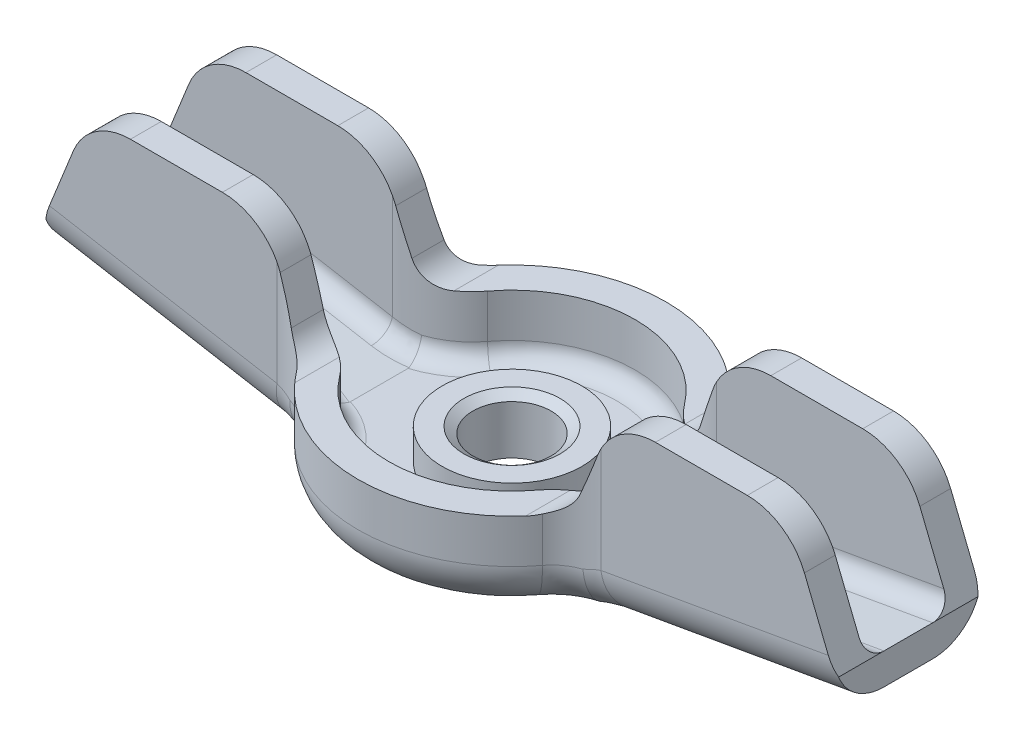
SolidWorks part; units mm, degrees
ref_plane "Front Plane" through (0, 0, 0) normal (0, 0, 1) x (1, 0, 0)
ref_plane "Top Plane" through (0, 0, 0) normal (0, 1, 0) x (1, 0, 0)
ref_plane "Right Plane" through (0, 0, 0) normal (1, 0, 0) x (0, 0, -1)
sketch "WingSke" plane through (0, 0, 0) normal (0, 1, 0) x (1, 0, 0)
  line L0 (4.4703, 2.413) -> (13.081, 2.413)
  line L1 (-13.081, 2.413) -> (-4.4703, 2.413)
  line L2 (-13.081, 2.413) -> (-13.081, -2.413)
  line L3 (-13.081, -2.413) -> (-4.4703, -2.413)
  line L4 (13.081, 2.413) -> (13.081, -2.413)
  line L5 (-13.081, 2.413) -> (13.081, -2.413) construction
  line L6 (-13.081, -2.413) -> (13.081, 2.413) construction
  line L7 (4.4703, -2.413) -> (13.081, -2.413)
  line L8 (-3.81, 3.3601) -> (-3.81, -3.3601) construction
  line L9 (3.81, -3.3601) -> (3.81, 3.3601) construction
  arc A2 (4.4703, 2.413) -> (-4.4703, 2.413) centre (0, 0) ccw
  circle A3 centre (0, 0) radius 4.064 construction
  arc A4 (-4.4703, -2.413) -> (4.4703, -2.413) centre (0, 0) ccw
  circle A5 centre (0, 0) radius 1.2891
extrude "Wing" add sketch "WingSke" along normal blind 6.35
sketch "WallSke" plane through (0, 0, 0) normal (0, 0, 1) x (1, 0, 0)
  line L3 (-3.81, 3.048) -> (3.81, 3.048)
  line L5 (-13.081, 1.5183) -> (-4.4703, 0)
  line L6 (-4.4703, 0) -> (-4.4703, -2.54)
  line L7 (-4.4703, -2.54) -> (-13.081, -2.54)
  line L8 (-13.081, -2.54) -> (-13.081, 1.5183)
  line L9 (-13.081, 6.35) -> (-13.081, 0) construction
  line L11 (4.4703, 0) -> (4.4703, -2.54)
  line L12 (4.4703, -2.54) -> (13.081, -2.54)
  line L13 (13.081, -2.54) -> (13.081, 1.5183)
  line L14 (13.081, 6.35) -> (13.081, 0) construction
  line L15 (-5.2366, 5.013) -> (-4.7647, 3.7165)
  line L16 (-13.081, 2.55) -> (-12.065, 5.0762)
  line L17 (-13.081, 6.35) -> (-4.4703, 6.35) construction
  line L18 (-4.4703, 6.35) -> (-4.4703, 0) construction
  line L19 (-4.4703, 6.35) -> (-4.4703, 7.366) construction
  line L20 (4.4703, 0) -> (13.081, 1.5183)
  line L21 (-13.081, 1.5183) -> (-12.9046, 2.5189) construction
  line L22 (-12.9046, 2.5189) -> (-13.081, 2.55) construction
  line L23 (-13.081, 2.55) -> (-13.081, 7.366)
  line L24 (-13.081, 7.366) -> (13.081, 7.366)
  line L25 (13.081, 7.366) -> (13.081, 2.55)
  line L26 (4.7647, 3.7165) -> (5.2366, 5.013)
  line L27 (-12.065, 5.0762) -> (-13.081, 5.0762) construction
  line L28 (-10.1798, 6.35) -> (-7.1461, 6.35)
  line L29 (13.081, 2.55) -> (12.065, 5.0762)
  line L30 (4.4703, 6.35) -> (13.081, 6.35) construction
  line L31 (10.1798, 6.35) -> (7.1461, 6.35)
  arc A4 (3.81, 3.048) -> (4.7647, 3.7165) centre (3.81, 4.064) ccw
  arc A5 (-4.7647, 3.7165) -> (-3.81, 3.048) centre (-3.81, 4.064) ccw
  arc A6 (12.065, 5.0762) -> (10.1798, 6.35) centre (10.1798, 4.318) ccw
  arc A7 (-12.065, 5.0762) -> (-10.1798, 6.35) centre (-10.1798, 4.318) cw
  arc A8 (7.1461, 6.35) -> (5.2366, 5.013) centre (7.1461, 4.318) ccw
  arc A9 (-7.1461, 6.35) -> (-5.2366, 5.013) centre (-7.1461, 4.318) cw
  point P6 (0, 3.048)
  point P38 (11.5527, 6.35)
  point P47 (-11.5527, 6.35)
fillet "Fillet5" radius 1.6087 4 edges at (4.4703, 3.175, -2.413) (-4.4703, 3.175, -2.413) (4.4703, 3.175, 2.413) (-4.4703, 3.175, 2.413)
extrude "Wall" cut sketch "WallSke" against normal through all both and the other way through all
fillet "Fillet4" radius 1.6087 14 edges at (-9.2128, 0.8362, 2.413) (-9.2128, 0.8362, -2.413) (0, 0, -5.08) (0, 0, 5.08) (4.2479, 0, -2.8448) (-4.2479, 0, -2.8448) (-4.8888, 0.0738, -2.4789) (4.2479, 0, 2.8448) (-4.2479, 0, 2.8448) (-4.8888, 0.0738, 2.4789) (4.8888, 0.0738, 2.4789) (4.8888, 0.0738, -2.4789) (9.2128, 0.8362, 2.413) (9.2128, 0.8362, -2.413)
shell "WingShell" thickness 1.016
sketch "ChamferSke" plane through (0, 0, 0) normal (0, 0, 1) x (1, 0, 0)
  line L0 (1.2891, 1.823) -> (1.5875, 2.032)
  line L1 (1.5875, 2.032) -> (2.3051, 2.032)
  line L2 (2.3051, 2.032) -> (2.3051, 3.048)
  line L3 (2.3051, 3.048) -> (1.2891, 3.048)
  line L4 (1.2891, 3.048) -> (1.2891, 1.823)
  line L5 (1.2891, 0.209) -> (1.5875, 0)
  line L6 (-2.7738, 0) -> (2.7738, 0) construction
  line L7 (1.5875, 0) -> (1.2891, 0)
  line L8 (1.2891, 0) -> (1.2891, 0.209)
  line L9 (0, 0) -> (0, 3.048) construction
  line L10 (3.81, 3.048) -> (-3.81, 3.048) construction
  line L11 (2.3051, 1.016) -> (2.3051, 3.048) construction
  line L12 (2.3051, 3.048) -> (-2.3051, 3.048) construction
revolve "Chamfers" cut sketch "ChamferSke" angle 360 about L9
sketch "ThdSchSke" plane through (0, 0, 0) normal (0, 0, 1) x (1, 0, 0)
  line L0 (0, 0) -> (0, 2.032) construction
  line L2 (-0.6445, 2.2156) -> (-0.6445, 1.7976)
  line L3 (-0.6445, 1.7976) -> (-1.2891, 1.7976)
  line L4 (-1.2891, 1.7976) -> (-1.5875, 2.0066)
  line L5 (-1.5875, 2.0066) -> (-1.2891, 2.2156)
  line L6 (-1.2891, 2.2156) -> (-0.6445, 2.2156)
  line L7 (0, 1.4783) -> (1.8294, 1.4783) construction
  line L8 (2.3051, 2.032) -> (-2.305, 2.032) construction
  line L9 (1.5875, 2.032) -> (-1.5875, 2.032) construction
revolve "ThreadSchematic" [suppressed] cut sketch "ThdSchSke" angle 360 about L0
pattern_linear "ThdSchPat" [suppressed] count 5 spacing 0.5017
equation "\"D1@Fillet4\"=\"WingThicknessC@WingSke\"/3"
equation "\"D1@Fillet5\"=\"WingThicknessC@WingSke\"/3"
equation "\"D1@ChamferSke\" = \"Thread_Major@ThreadCosmetic\" * 0.5"
equation "\"D1@ThdSchPat\"=int(  (\"BossHeightG@ChamferSke\" - 0.002 ) / \"Advance@ThdSchSke\" + 0.999 )  + 1"
equation "\"Thread_major@ThdSchSke\"=\"Thread_Major@ThreadCosmetic\""
equation "\"Tap_drill@ThdSchSke\"=\"Thread_min@WingSke\""
equation "\"D3@WallSke\"=\"ThicknessT@WingSke\""
equation "\"D1@WingShell\"=\"ThicknessT@WingSke\""
equation "\"D5@WallSke\"=\"D3@WallSke\""
equation "\"D4@WallSke\"=\"D3@WallSke\"*2"
